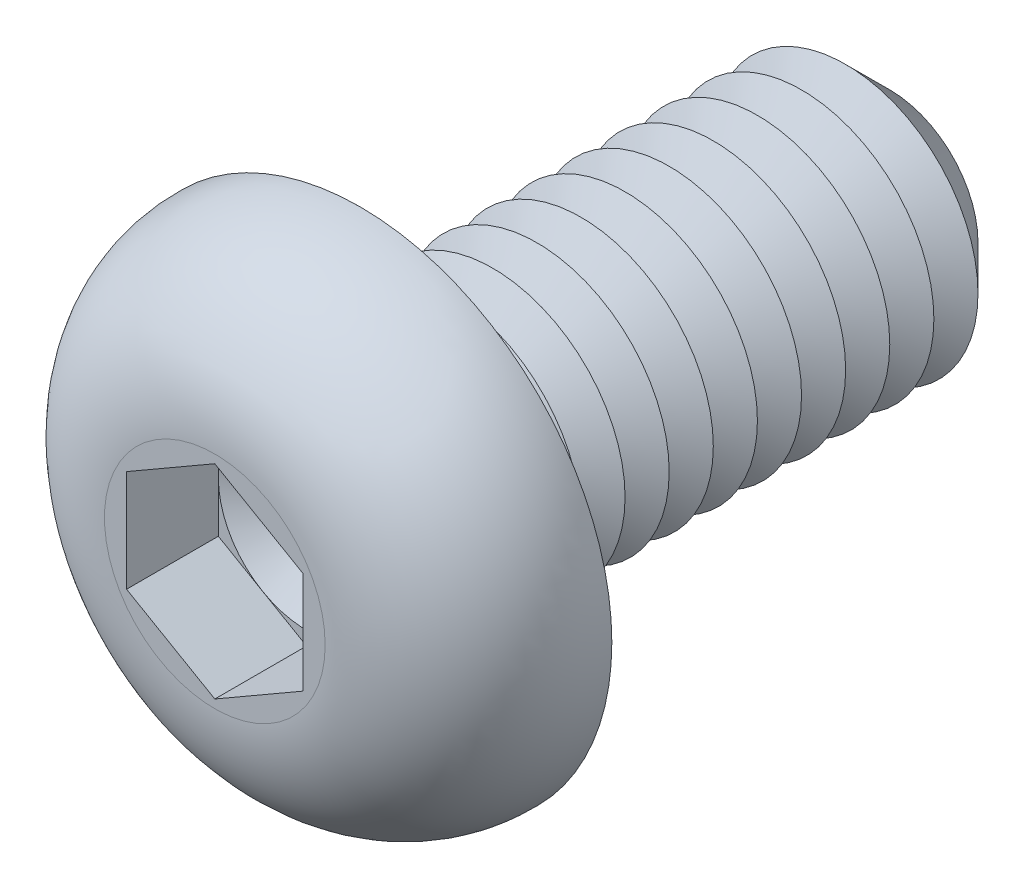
SolidWorks part; units mm, degrees
ref_plane "Front Plane" through (0, 0, 0) normal (0, 0, 1) x (1, 0, 0)
ref_plane "Top Plane" through (0, 0, 0) normal (0, 1, 0) x (1, 0, 0)
ref_plane "Right Plane" through (0, 0, 0) normal (1, 0, 0) x (0, 0, -1)
sketch "Sketch1" plane through (0, 0, 0) normal (1, 0, 0) x (0, 0, -1)
  line L0 (-47.9342, 0) -> (60.3146, 0) construction
sketch "Sketch2" plane through (0, 0, 0) normal (1, 0, 0) x (0, 0, -1)
  line L0 (0, 0) -> (-1.65, 0)
  line L1 (-47.9342, 0) -> (60.3146, 0) construction
  line L2 (-1.65, 0) -> (-1.65, 1.2508)
  line L3 (0, 2.85) -> (0, 0)
  arc A0 (-1.65, 1.2508) -> (0, 2.85) centre (-0.05, 1.2508) cw
  dimension "D1" = 1.6
  dimension "D2" = 1.65
  dimension "D3" = 2.85
revolve "Revolve1" add sketch "Sketch2" angle 360 about L0
sketch "Sketch3" plane through (0, 0, 1.65) normal (0, 0, 1) x (1, 0, 0)
  line L1 (0, 1.1547) -> (-1, 0.5774)
  line L2 (-1, 0.5774) -> (-1, -0.5774)
  line L3 (-1, -0.5774) -> (0, -1.1547)
  line L4 (0, -1.1547) -> (1, -0.5774)
  line L5 (1, -0.5774) -> (1, 0.5774)
  line L6 (1, 0.5774) -> (0, 1.1547)
  circle A0 centre (0, 0) radius 1 construction
  dimension "D1" = 2
extrude "Cut-Extrude1" cut sketch "Sketch3" against normal blind 1.04
sketch "Sketch4" plane through (0, 0, 0) normal (0, 0, -1) x (-1, 0, 0)
  circle A0 centre (0, 0) radius 1.5
  dimension "D1" = 3
extrude "Boss-Extrude1" add sketch "Sketch4" along normal blind 6
chamfer "Chamfer1" distance 0.5 angle 45 1 edges at (-1.5, 0, -6)
sketch "Sketch5" plane through (0, 0, 0) normal (1, 0, 0) x (0, 0, -1)
  line L0 (0.5, 1.5) -> (1, 1.5)
  line L1 (5.5, 1.5) -> (0, 1.5) construction
  line L2 (1, 1.5) -> (0.75, 1.067)
  line L3 (0.75, 1.067) -> (0.5, 1.5)
  line L4 (0, -2.85) -> (0, 2.85) construction
  line L5 (5.5, 1.5) -> (0, 1.5) construction
  dimension "D1" = 0.5
  dimension "D2" = 0.5
revolve "Cut-Revolve1" cut sketch "Sketch5" angle 360 about L0
pattern_linear "LPattern1" count 10 spacing 0.5 along (0, 0, -1) of "Cut-Revolve1"
fillet "Fillet2" radius 0.2 1 edges at (1.5, 0, 0)
sketch "Sketch6" plane through (0, 0, 0.61) normal (0, 0, 1) x (1, 0, 0)
  line L0 (0, -1.1547) -> (1, -0.5774) construction
  circle A0 centre (0, 0) radius 1
extrude "Cut-Extrude2" cut sketch "Sketch6" against normal through all draft 60
